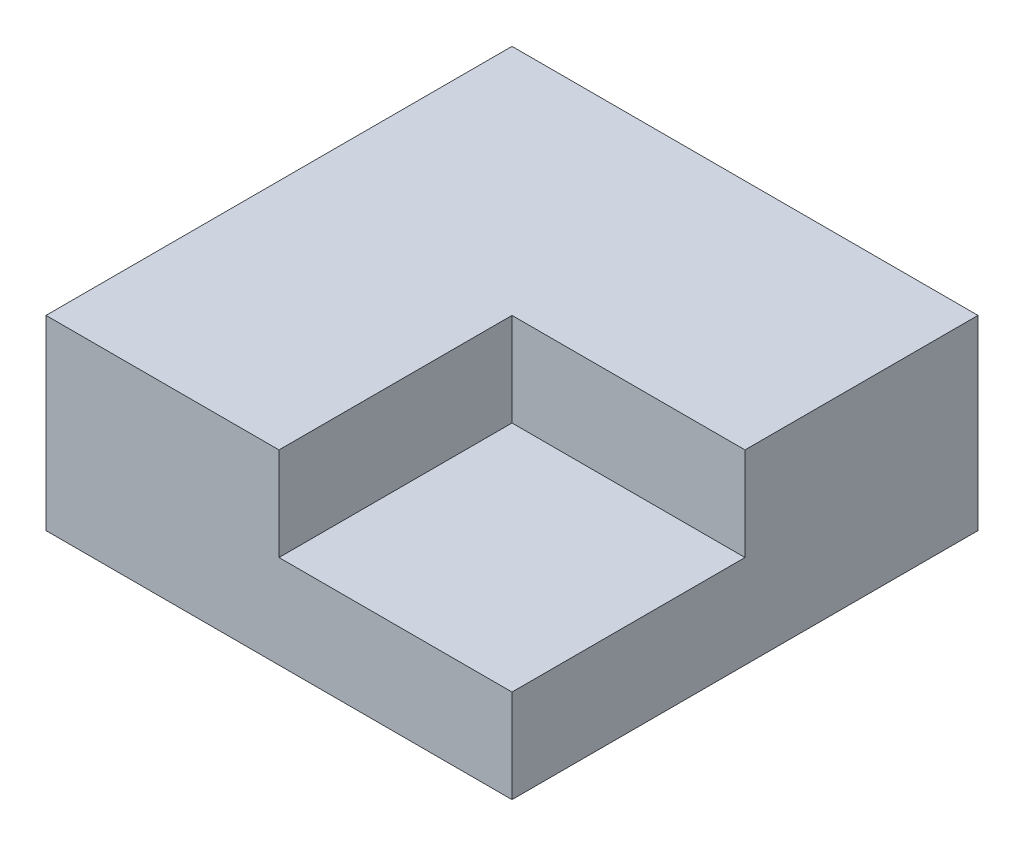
SolidWorks part; units mm, degrees
ref_plane "Front Plane" through (0, 0, 0) normal (0, 0, 1) x (1, 0, 0)
ref_plane "Top Plane" through (0, 0, 0) normal (0, 1, 0) x (1, 0, 0)
ref_plane "Right Plane" through (0, 0, 0) normal (1, 0, 0) x (0, 0, -1)
sketch "Sketch1" plane through (0, 0, 0) normal (0, 1, 0) x (1, 0, 0)
  line L1 (0, 0) -> (50, 0)
  line L2 (0, 0) -> (0, 50)
  line L3 (0, 50) -> (50, 50)
  line L4 (50, 0) -> (50, 50)
  dimension "D1" = 50
  dimension "D2" = 50
extrude "Extrude1" add sketch "Sketch1" along normal blind 20
sketch "Sketch2" plane through (0, 20, 0) normal (0, 1, 0) x (-1, 0, 0)
  line L0 (0, 0) -> (-50, 0) construction
  line L1 (-25, 0) -> (-50, 0)
  line L2 (-25, 0) -> (-25, -25)
  line L3 (-25, -25) -> (-50, -25)
  line L4 (-50, 0) -> (-50, -25)
  line L5 (-50, 0) -> (-50, -50) construction
extrude "Cut-Extrude1" cut sketch "Sketch2" against normal blind 10
